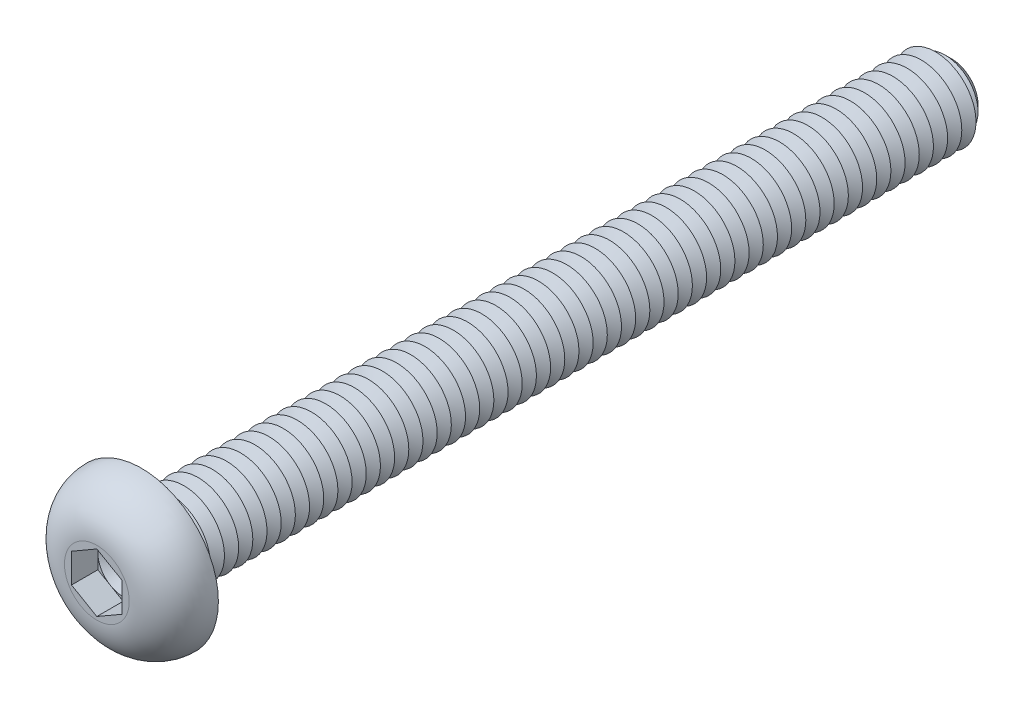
SolidWorks part; units mm, degrees
ref_plane "Front Plane" through (0, 0, 0) normal (0, 0, 1) x (1, 0, 0)
ref_plane "Top Plane" through (0, 0, 0) normal (0, 1, 0) x (1, 0, 0)
ref_plane "Right Plane" through (0, 0, 0) normal (1, 0, 0) x (0, 0, -1)
sketch "Sketch1" plane through (0, 0, 0) normal (1, 0, 0) x (0, 0, -1)
  line L0 (-47.9342, 0) -> (60.3146, 0) construction
sketch "Sketch2" plane through (0, 0, 0) normal (1, 0, 0) x (0, 0, -1)
  line L0 (0, 0) -> (-2.2, 0)
  line L1 (-47.9342, 0) -> (60.3146, 0) construction
  line L2 (-2.2, 0) -> (-2.2, 1.6)
  line L3 (0, 3.8) -> (0, 0)
  arc A0 (-2.2, 1.6) -> (0, 3.8) centre (0, 1.6) cw
  dimension "D1" = 2.2
  dimension "D2" = 2.2
  dimension "D3" = 3.8
revolve "Revolve1" add sketch "Sketch2" angle 360 about L0
sketch "Sketch3" plane through (0, 0, 2.2) normal (0, 0, 1) x (1, 0, 0)
  line L1 (0, 1.4434) -> (-1.25, 0.7217)
  line L2 (-1.25, 0.7217) -> (-1.25, -0.7217)
  line L3 (-1.25, -0.7217) -> (0, -1.4434)
  line L4 (0, -1.4434) -> (1.25, -0.7217)
  line L5 (1.25, -0.7217) -> (1.25, 0.7217)
  line L6 (1.25, 0.7217) -> (0, 1.4434)
  circle A0 centre (0, 0) radius 1.25 construction
  dimension "D1" = 2.5
extrude "Cut-Extrude1" cut sketch "Sketch3" against normal blind 1.3
sketch "Sketch4" plane through (0, 0, 0) normal (0, 0, -1) x (-1, 0, 0)
  circle A0 centre (0, 0) radius 2
  dimension "D1" = 4
extrude "Boss-Extrude1" add sketch "Sketch4" along normal blind 40
chamfer "Chamfer1" distance 0.7 angle 45 1 edges at (-2, 0, -40)
sketch "Sketch5" plane through (0, 0, 0) normal (1, 0, 0) x (0, 0, -1)
  line L0 (0.7, 2) -> (1.4, 2)
  line L1 (39.3, 2) -> (0, 2) construction
  line L2 (1.4, 2) -> (1.05, 1.3938)
  line L3 (1.05, 1.3938) -> (0.7, 2)
  line L4 (0, -3.8) -> (0, 3.8) construction
  line L5 (39.3, 2) -> (0, 2) construction
  dimension "D1" = 0.7
  dimension "D2" = 0.7
revolve "Cut-Revolve1" cut sketch "Sketch5" angle 360 about L0
pattern_linear "LPattern1" count 56 spacing 0.7 along (0, 0, -1) of "Cut-Revolve1"
fillet "Fillet2" radius 0.3 1 edges at (2, 0, 0)
sketch "Sketch6" plane through (0, 0, 0.9) normal (0, 0, 1) x (1, 0, 0)
  line L0 (0, -1.4434) -> (1.25, -0.7217) construction
  circle A0 centre (0, 0) radius 1.25
extrude "Cut-Extrude2" cut sketch "Sketch6" against normal through all draft 60
